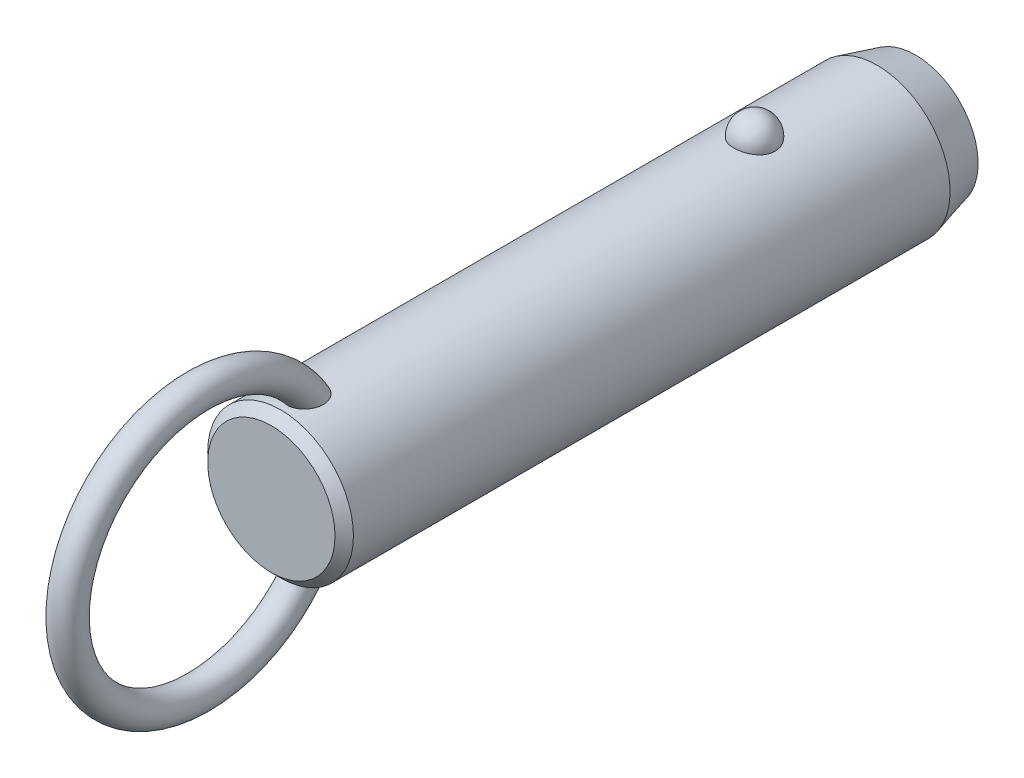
SolidWorks part; units mm, degrees
ref_plane "Front Plane" through (0, 0, 0) normal (0, 0, 1) x (1, 0, 0)
ref_plane "Top Plane" through (0, 0, 0) normal (0, 1, 0) x (1, 0, 0)
ref_plane "Right Plane" through (0, 0, 0) normal (1, 0, 0) x (0, 0, -1)
sketch "Sketch2" plane through (0, 0, 0) normal (0, 0, 1) x (1, 0, 0)
  circle A0 centre (0, 0) radius 9.5
  point P3 (0, 9.5)
  dimension "D1" = 19
extrude "Boss-Extrude1" add sketch "Sketch2" along normal blind 50.8
sketch "Sketch3" plane through (0, 0, 0) normal (0, 0, -1) x (-1, 0, 0)
  circle A0 centre (0, 0) radius 9.5
  dimension "D1" = 19
extrude "Boss-Extrude2" add sketch "Sketch3" along normal blind 23.7
chamfer "Chamfer1" distance 5 angle 15 1 edges at (-9.5, 0, -23.7)
sketch "Sketch12" plane through (0, 0, 0) normal (1, 0, 0) x (0, 0, -1)
  line L0 (-50.8, 9.5) -> (-50.8, -9.5) construction
  point P0 (-50.8, 0)
sketch "Sketch13" plane through (0, 0, 0) normal (1, 0, 0) x (0, 0, -1)
  circle A0 centre (-69.85, 0) radius 19.05
  point P2 (-50.8, 0)
  dimension "D1" = 38.1
sketch "Sketch14" plane through (0, 0, 0) normal (0, 1, 0) x (1, 0, 0)
  circle A0 centre (0, -52.8) radius 2
  point P2 (0, -50.8)
  dimension "D1" = 4
sweep "Sweep1" add profiles "Sketch14" path "Sketch13"
sketch "Sketch15" plane through (0, 0, 50.8) normal (0, 0, 1) x (1, 0, 0)
  circle A0 centre (0, 0) radius 9.5
  dimension "D1" = 19
extrude "Boss-Extrude3" add sketch "Sketch15" along normal blind 9.52
chamfer "Chamfer2" distance 1.2 angle 45 1 edges at (9.5, 0, 60.32)
sketch "Sketch18" plane through (0, 0, 0) normal (1, 0, 0) x (0, 0, -1)
  line L0 (18.7, 9.5) -> (-53.3378, 9.5) construction
  line L1 (2.7, 12.2) -> (2.7, 6.8)
  line L2 (-53.3378, -9.5) -> (18.7, -9.5) construction
  arc A0 (2.7, 12.2) -> (2.7, 6.8) centre (2.7, 9.5) ccw
  point P4 (0, 9.5)
  dimension "D1" = 21.7
revolve "Revolve1" add sketch "Sketch18" angle 360 about L1
